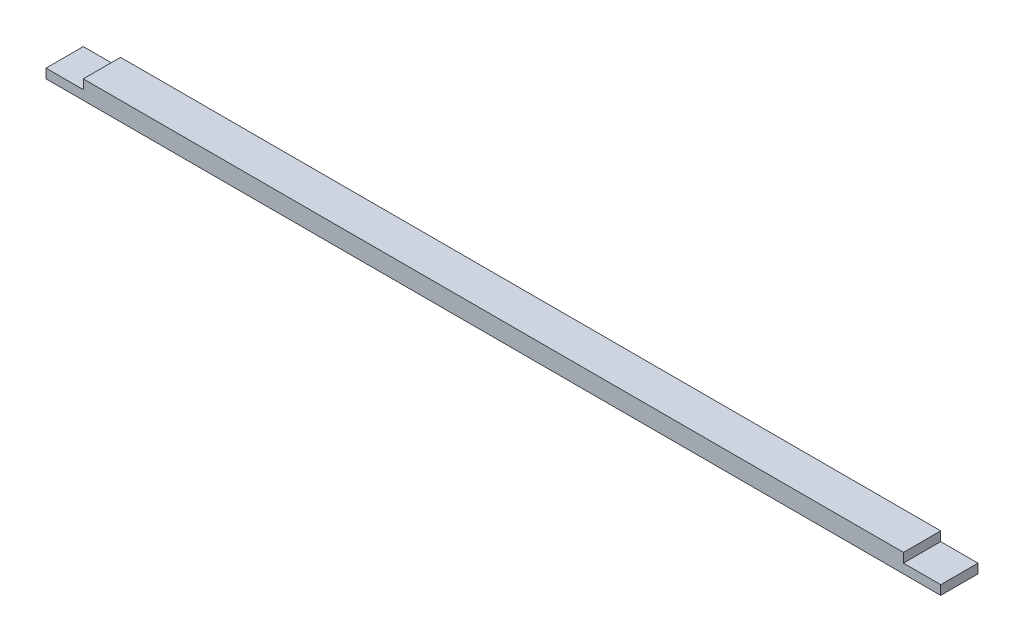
SolidWorks part; units mm, degrees
ref_plane "Front Plane" through (0, 0, 0) normal (0, 0, 1) x (1, 0, 0)
ref_plane "Top Plane" through (0, 0, 0) normal (0, 1, 0) x (1, 0, 0)
ref_plane "Right Plane" through (0, 0, 0) normal (1, 0, 0) x (0, 0, -1)
sketch "Sketch2" plane through (0, 0, 0) normal (0, 1, 0) x (1, 0, 0)
  line L1 (-1219.2, -1168.4) -> (1219.2, -1168.4)
  line L2 (-1219.2, -1168.4) -> (-1219.2, -1270)
  line L3 (-1219.2, -1270) -> (1219.2, -1270)
  line L4 (1219.2, -1168.4) -> (1219.2, -1270)
  line L5 (-1219.2, -1168.4) -> (1219.2, -1270) construction
  line L6 (-1219.2, -1270) -> (1219.2, -1168.4) construction
  point P0 (0, 0)
  point P5 (0, 0)
  point P6 (0, -1219.2)
  point P7 (0, 0)
  dimension "D1" = 101.6
  dimension "D2" = 2438.4
  dimension "D3" = 1219.2
extrude "Boss-Extrude1" add sketch "Sketch2" along normal blind 50.8
sketch "Sketch3" plane through (0, 50.8, 0) normal (0, 1, 0) x (1, 0, 0)
  line L0 (1219.2, -1168.4) -> (-1219.2, -1168.4) construction
  line L1 (1219.2, -1270) -> (1117.6, -1270)
  line L2 (1219.2, -1270) -> (1219.2, -1168.4)
  line L3 (1219.2, -1168.4) -> (1117.6, -1168.4)
  line L4 (1117.6, -1270) -> (1117.6, -1168.4)
  dimension "D1" = 101.6
extrude "Cut-Extrude1" cut sketch "Sketch3" against normal blind 25.4
mirror "Mirror1" about plane through (0, 0, 0) normal (1, 0, 0) of "Cut-Extrude1"
